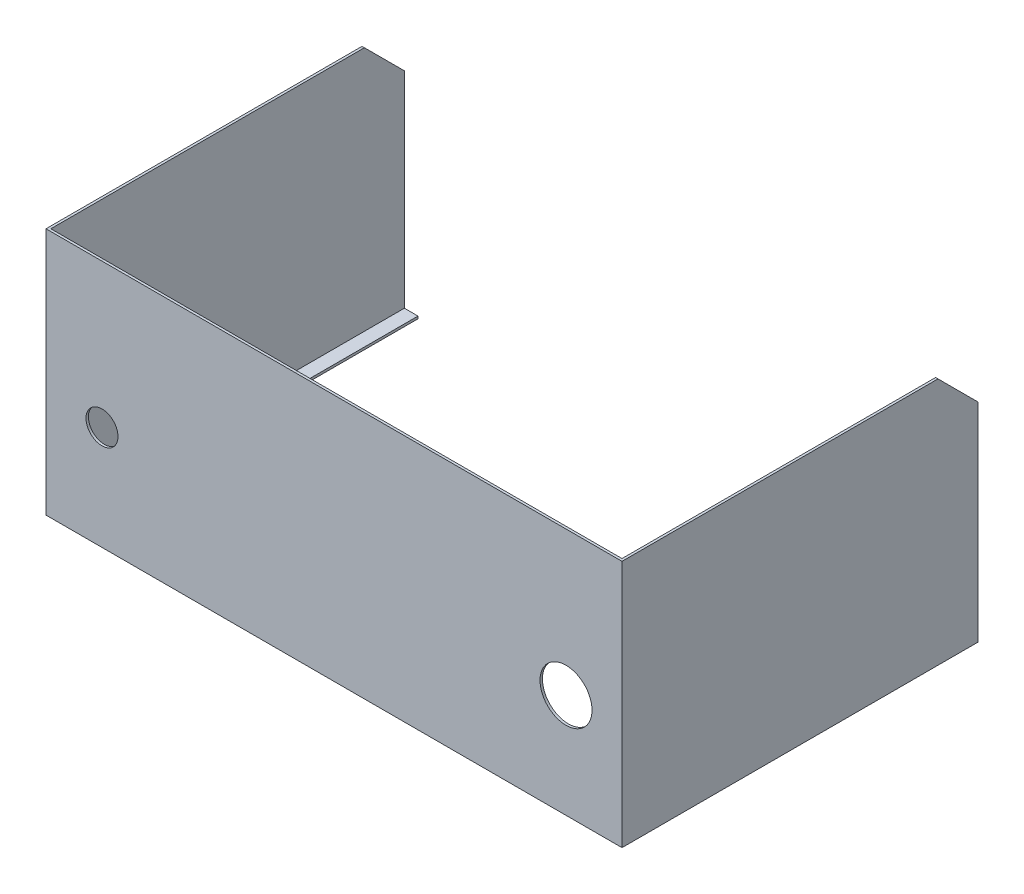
SolidWorks part; units mm, degrees
ref_plane "前视基准面" through (0, 0, 0) normal (0, 0, 1) x (1, 0, 0)
ref_plane "上视基准面" through (0, 0, 0) normal (0, 1, 0) x (1, 0, 0)
ref_plane "右视基准面" through (0, 0, 0) normal (1, 0, 0) x (0, 0, -1)
sketch "草图1" plane through (0, 0, 0) normal (0, 0, 1) x (1, 0, 0)
  line L1 (360, 155) -> (-360, 155)
  line L2 (360, 155) -> (360, -155)
  line L3 (360, -155) -> (-360, -155)
  line L4 (-360, 155) -> (-360, -155)
  line L5 (360, 155) -> (-360, -155) construction
  line L6 (360, -155) -> (-360, 155) construction
  circle A0 centre (-290, -25) radius 20
  circle A1 centre (290, -25) radius 32.5
  point P0 (0, 0)
  dimension "D3" = 70
  dimension "D1" = 720
  dimension "D2" = 310
  dimension "D4" = 70
  dimension "D5" = 130
  dimension "D6" = 130
extrude "凸台-拉伸1" add sketch "草图1" along normal blind 3
sketch "草图2" plane through (360, 0, 0) normal (1, 0, 0) x (0, 0, -1)
  line L0 (0, -155) -> (0, 155) construction
  line L1 (0, -155) -> (0, 155)
  line L2 (0, -155) -> (442, -155)
  line L3 (0, 155) -> (392, 155)
  line L4 (442, -155) -> (442, 105)
  line L5 (392, 155) -> (442, 105)
extrude "凸台-拉伸2" add sketch "草图2" against normal blind 3
sketch "草图3" plane through (-360, 0, 0) normal (-1, 0, 0) x (0, 0, 1)
  line L5 (-442, -155) -> (0, -155)
  line L6 (0, -155) -> (0, 155)
  line L7 (0, 155) -> (-392, 155)
  line L8 (-392, 155) -> (-442, 105)
  line L9 (-442, 105) -> (-442, -155)
  line L10 (-442, -155) -> (0, -155)
  line L11 (0, -155) -> (0, 155)
  line L12 (0, 155) -> (-392, 155)
  line L13 (-392, 155) -> (-442, 105)
  line L14 (-442, 105) -> (-442, -155)
  dimension "D1" = 0
extrude "凸台-拉伸5" add sketch "草图3" against normal blind 3
sketch "草图5" plane through (0, -155, 0) normal (0, -1, 0) x (1, 0, 0)
  line L0 (357, 0) -> (357, -442) construction
  line L1 (-357, 0) -> (357, 0) construction
  line L2 (-357, -442) -> (-357, 0) construction
  line L3 (357, 0) -> (357, -442)
  line L4 (-357, 0) -> (357, 0)
  line L5 (-357, -442) -> (-357, 0)
  line L6 (-357, -442) -> (-340, -442)
  line L7 (357, -442) -> (340, -442)
  line L8 (-340, -442) -> (-340, -17)
  line L9 (340, -442) -> (340, -17)
  line L10 (-340, -17) -> (340, -17)
extrude "凸台-拉伸8" add sketch "草图5" against normal blind 3 contours L8 L10 L9 L7 L6 M5 M4 M3
